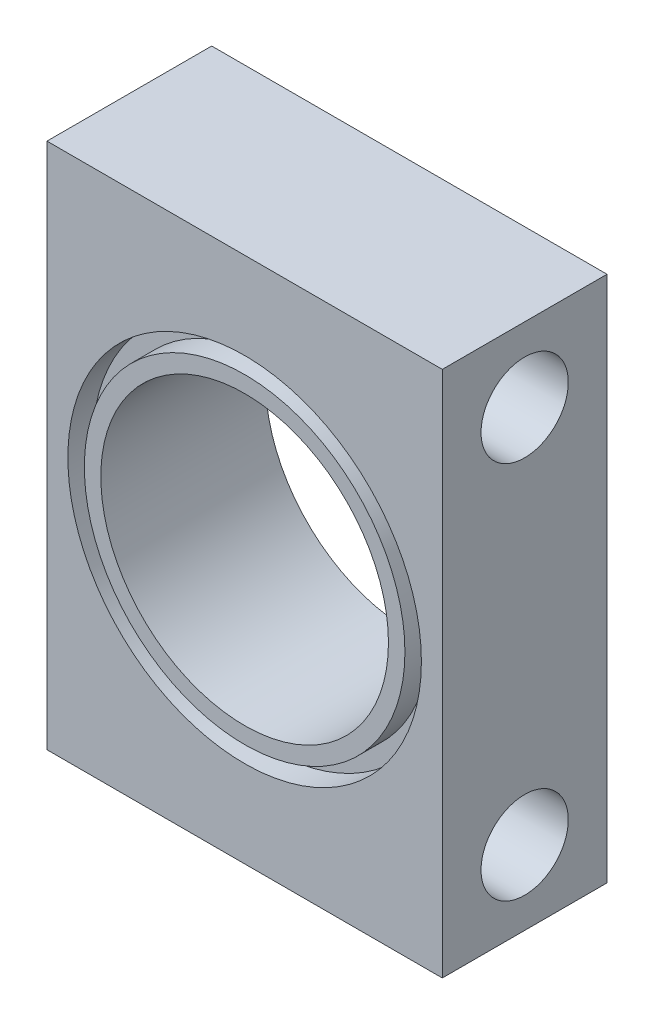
SolidWorks part; units mm, degrees
ref_plane "Front Plane" through (0, 0, 0) normal (0, 0, 1) x (1, 0, 0)
ref_plane "Top Plane" through (0, 0, 0) normal (0, 1, 0) x (1, 0, 0)
ref_plane "Right Plane" through (0, 0, 0) normal (1, 0, 0) x (0, 0, -1)
sketch "Sketch1" plane through (0, 0, 0) normal (0, 0, 1) x (1, 0, 0)
  line L0 (0, 16) -> (-12, 16)
  line L1 (0, 16) -> (12, 16)
  line L2 (-12, 16) -> (-12, -16)
  line L3 (0, -16) -> (12, -16)
  line L4 (12, 16) -> (12, -16)
  line L5 (-12, -16) -> (0, -16)
  arc A0 (0, 16) -> (0, -16) centre (0, 0) ccw construction
  circle A1 centre (0, 0) radius 8.7312
  dimension "D1" = 16
  dimension "D2" = 17.4625
  dimension "D3" = 12
  dimension "D4" = 32
  dimension "D5" = 32
  dimension "D6" = 12
  dimension "D7" = 12
extrude "Boss-Extrude1" add sketch "Sketch1" along normal mid plane 10
ref_plane "Plane2" through (-13.4, 0, 0) normal (1, 0, 0) x (0, 0, -1)
sketch "Sketch3" plane through (-13.4, 0, 0) normal (1, 0, 0) x (0, 0, -1)
  line L0 (0, 17.0024) -> (0, -17.2089) construction
  line L1 (-3.8575, 0) -> (5.5386, 0) construction
  line L2 (-6.0602, 11.5) -> (4.9535, 11.5) construction
  line L3 (-5.4407, -11.5) -> (5.4407, -11.5) construction
  circle A0 centre (0, 11.5) radius 1.8288
  circle A1 centre (0, -11.5) radius 1.8288
  dimension "D3" = 3.6576
  dimension "D1" = 11.5
  dimension "D2" = 11.5
extrude "Cut-Extrude1" [suppressed] cut sketch "Sketch3" against normal through all
ref_plane "Plane1" through (-13.4, 0, 0) normal (1, 0, 0) x (0, 0, -1)
sketch "Sketch4" [suppressed] plane through (-15.875, 0, 0) normal (1, 0, 0) x (0, 0, -1)
  circle A0 centre (0, 12.7) radius 2.8702
  circle A1 centre (0, -12.7) radius 2.8702
  dimension "D1" = 5.7404
  dimension "D2" = 5.7404
extrude "Cut-Extrude2" [suppressed] cut sketch "Sketch4" along normal blind 6.35
hole_wizard "M5 Clearance Hole1" positions "3DSketch1" profile "Sketch5" hole size "M5" standard "Ansi Metric"
sketch3d "3DSketch1"
  point P0 (-13.4, 11.5, 0)
  point P3 (-13.4, -11.5, 0)
sketch "Sketch5" plane through (-13.4, 11.5, 0) normal (0, 1, 0) x (0, 0, 1)
  line L0 (0, 0) -> (0, 26.9923)
  line L1 (0, 26.9923) -> (2.65, 25.4)
  line L2 (2.65, 25.4) -> (2.65, 0)
  line L5 (2.65, 0) -> (0, 0)
  line L10 (0, 26.9923) -> (-2.65, 25.4) construction
  line L11 (0, -6.35) -> (0, 107.95) construction
  dimension "Hole Dia." = 5.3
  dimension "Hole Depth" = 25.4
  dimension "Drill Angle" = 118
sketch "Sketch6" plane through (0, 0, 5) normal (0, 0, 1) x (1, 0, 0)
  line L0 (0, 20.5937) -> (0, -17.7277) construction
  line L1 (-15.8839, 0) -> (19.0373, 0) construction
  circle A0 centre (0, 0) radius 9.7313
  circle A1 centre (0, 0) radius 10.7313
  circle A2 centre (0, 0) radius 8.7312 construction
  dimension "D1" = 1
  dimension "D2" = 1
extrude "Cut-Extrude3" cut sketch "Sketch6" against normal blind 1.5
